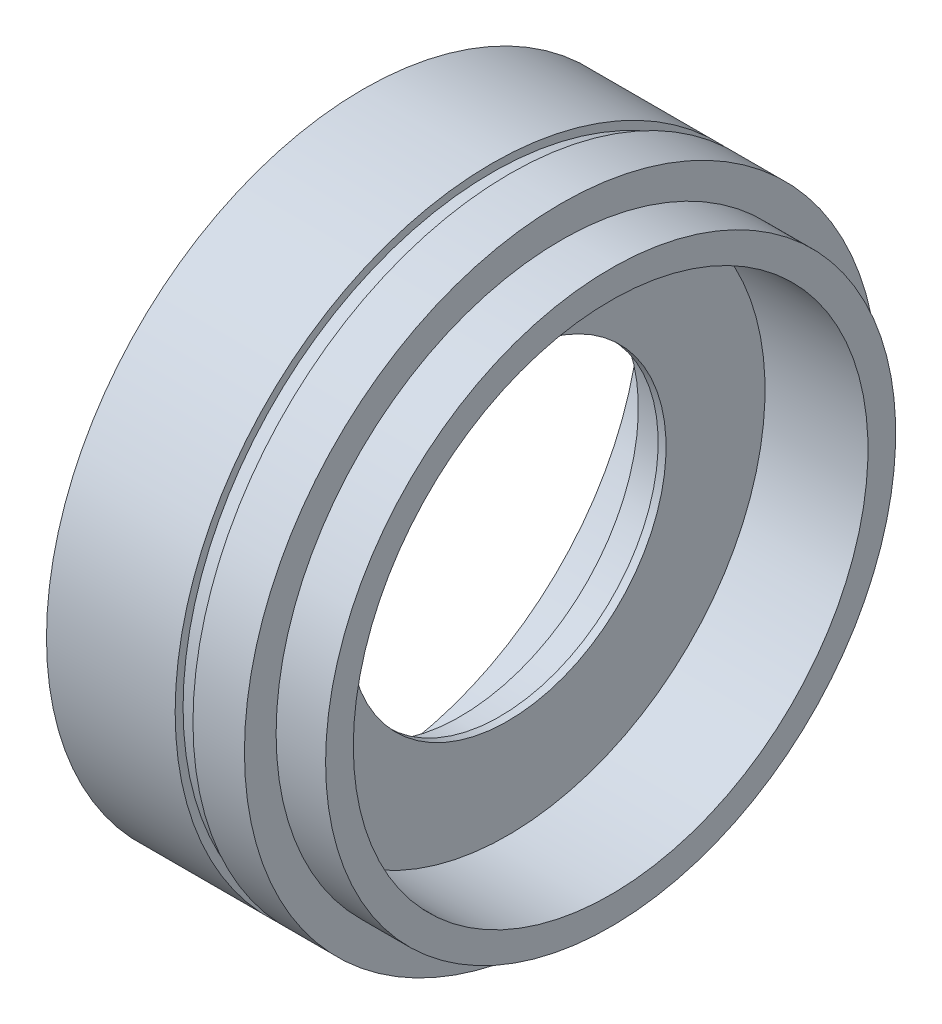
SolidWorks part; units mm, degrees
ref_plane "Face" through (0, 0, 0) normal (0, 0, 1) x (1, 0, 0)
ref_plane "Dessus" through (0, 0, 0) normal (0, 1, 0) x (1, 0, 0)
ref_plane "Droite" through (0, 0, 0) normal (1, 0, 0) x (0, 0, -1)
sketch "Esquisse1" plane through (0, 0, 0) normal (0, 0, 1) x (1, 0, 0)
  line L0 (0, 0) -> (73.0405, 0) construction
  line L1 (0, 80) -> (50, 80)
  line L2 (50, 80) -> (50, 72)
  line L3 (50, 72) -> (62.5, 72)
  line L6 (62.5, 72) -> (62.5, 65)
  line L7 (62.5, 65) -> (36.5, 65)
  line L8 (36.5, 65) -> (36.5, 40)
  line L9 (36.5, 40) -> (34.5, 40)
  line L10 (34.5, 40) -> (34.5, 45)
  line L11 (34.5, 45) -> (24.5, 45)
  line L12 (24.5, 45) -> (24.5, 70)
  line L13 (24.5, 70) -> (0, 70)
  line L14 (0, 70) -> (0, 80)
  dimension "D1" = 160
  dimension "D2" = 140
  dimension "D3" = 144
  dimension "D4" = 12.5
  dimension "D5" = 130
  dimension "D6" = 50
  dimension "D7" = 26
  dimension "D8" = 2
  dimension "D9" = 10
  dimension "D10" = 90
  dimension "D11" = 80
revolve "Révolution1" add sketch "Esquisse1" angle 360 about L0
hole_wizard "Dégagement M61" positions "Esquisse3" profile "Esquisse2" hole size "M6" standard "ISO"
sketch "Esquisse3" plane through (0, 71.6229, -16.4813) normal (1, 0, 0) x (0, 0, -1)
  circle A0 centre (-16.4813, -71.6229) radius 75 construction
  point P0 (-16.4813, 3.3771)
  dimension "D1" = 150
sketch "Esquisse2" plane through (0, 75, 0) normal (0, 1, 0) x (0, 0, 1)
  line L0 (0, 0) -> (0, 11.9828)
  line L1 (0, 11.9828) -> (3.3, 10)
  line L2 (3.3, 10) -> (3.3, 0)
  line L5 (3.3, 0) -> (0, 0)
  line L10 (0, 11.9828) -> (-3.3, 10) construction
  line L11 (0, -6.35) -> (0, 107.95) construction
  dimension "Diamètre du perçage" = 6.6
  dimension "Profondeur du perçage" = 10
  dimension "Angle de pointe" = 118
pattern_circular "Répétition circulaire1" count 4 over 360 about axis through (0, 0, 0) along (1, 0, 0) of "Dégagement M61"
sketch "Esquisse5" plane through (0, 0, 0) normal (0, 0, 1) x (1, 0, 0)
  line L1 (32.5, 80) -> (37, 80)
  line L2 (32.5, 80) -> (32.5, 78)
  line L3 (32.5, 78) -> (37, 78)
  line L4 (37, 80) -> (37, 78)
  line L5 (0, 80) -> (0, -80) construction
  line L6 (50, 80) -> (0, 80) construction
  dimension "D1" = 37
  dimension "D2" = 4.5
  dimension "D3" = 2
revolve "Enlèvement de matière-Révolution1" cut sketch "Esquisse5" angle 360 about axis through (0, 0, 0) along (1, 0, 0)
sketch "Esquisse6" plane through (50, 0, 0) normal (1, 0, 0) x (0, 0, -1)
  line L1 (-87.9964, -86.033) -> (102.6328, -86.033)
  line L2 (-87.9964, -86.033) -> (-87.9964, 0)
  line L3 (-87.9964, 0) -> (102.6328, 0)
  line L4 (102.6328, -86.033) -> (102.6328, 0)
extrude "Enlèv. mat.-Extru.1" [suppressed] cut sketch "Esquisse6" against normal mid plane 230
